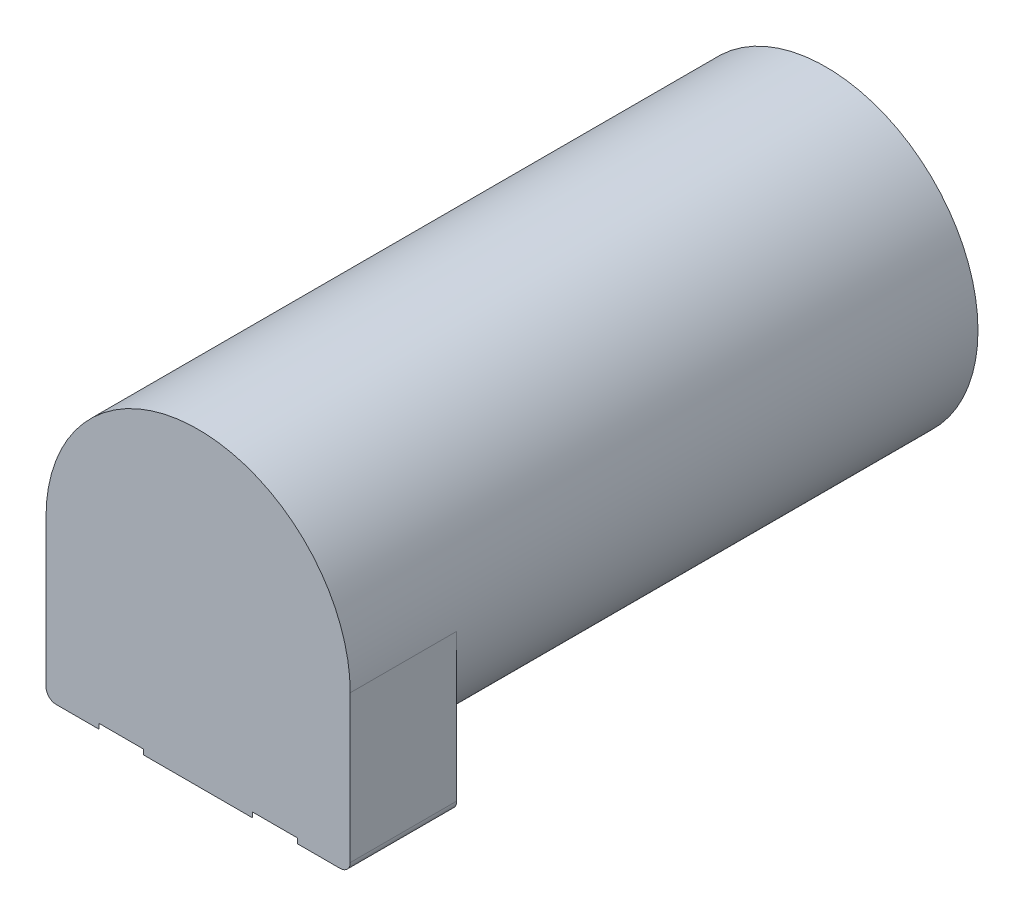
SolidWorks part; units mm, degrees
ref_plane "Face" through (0, 0, 0) normal (0, 0, 1) x (1, 0, 0)
ref_plane "Dessus" through (0, 0, 0) normal (0, 1, 0) x (1, 0, 0)
ref_plane "Droite" through (0, 0, 0) normal (1, 0, 0) x (0, 0, -1)
sketch "Esquisse1" plane through (0, 0, 0) normal (1, 0, 0) x (0, 0, -1)
  line L0 (0, 0) -> (36.7, 0) construction
  line L1 (0, 0) -> (0, 15.75)
  line L2 (0, 15.75) -> (5, 15.75)
  line L3 (5, 15.75) -> (5, 0)
  line L8 (0, 0) -> (5, 0)
  dimension "D2" = 5
  dimension "D4" = 31.5
revolve "Révolution1" add sketch "Esquisse1" angle 360 about L0
sketch "Esquisse5" plane through (0, 0, 0) normal (0, 0, 1) x (1, 0, 0)
  circle A0 centre (0, 0) radius 30
  dimension "D1" = 60
extrude "Extrusion2" add sketch "Esquisse5" along normal blind 123.8
sketch "Esquisse6" plane through (0, 0, 123.8) normal (0, 0, 1) x (1, 0, 0)
  line L0 (-30, 0) -> (-30, -29)
  line L1 (-28, -31) -> (28, -31)
  line L2 (30, -29) -> (30, 0)
  line L3 (30, 0) -> (-30, 0) construction
  circle A0 centre (0, 0) radius 30 construction
  arc A1 (-30, -29) -> (-28, -31) centre (-28, -29) ccw
  arc A2 (28, -31) -> (30, -29) centre (28, -29) ccw
  arc A4 (-30, 0) -> (30, 0) centre (0, 0) ccw
  dimension "D1" = 61
  dimension "D2" = 2
extrude "Extrusion3" add sketch "Esquisse6" against normal blind 21
sketch "Esquisse7" plane through (0, -31, 0) normal (0, -1, 0) x (1, 0, 0)
  line L0 (0, 123.8) -> (0, 112.1) construction
  line L1 (-28, 123.8) -> (28, 123.8) construction
  line L2 (-15.15, 112.1) -> (15.15, 112.1) construction
  circle A0 centre (-15.15, 112.1) radius 12.5
  circle A1 centre (15.15, 112.1) radius 12.5
  point P6 (15.15, 112.1)
  point P7 (-15.15, 112.1)
  dimension "D3" = 25
  dimension "D1" = 30.3
  dimension "D2" = 11.7
extrude "Enlèv. mat.-Extru.1" cut sketch "Esquisse7" against normal blind 1
sketch "Esquisse8" plane through (0, -30, 0) normal (0, -1, 0) x (1, 0, 0)
  circle A0 centre (15.15, 112.1) radius 7.475
  circle A1 centre (-15.15, 112.1) radius 7.475
  arc A2 (-6.7978, 102.8) -> (-10.75, 123.8) centre (-15.15, 112.1) ccw construction
  arc A3 (23.5022, 102.8) -> (19.55, 123.8) centre (15.15, 112.1) ccw construction
  dimension "D1" = 14.95
extrude "Enlèv. mat.-Extru.2" cut sketch "Esquisse8" against normal blind 30
sketch "Esquisse11" plane through (0, 0, 0) normal (0, 0, -1) x (-1, 0, 0)
  line L0 (0, 0) -> (0, -22.5) construction
  line L1 (0, 0) -> (15.9099, 15.9099) construction
  line L2 (15.9099, 15.9099) -> (-15.9099, 15.9099) construction
  line L3 (-15.9099, 15.9099) -> (0, 0) construction
  circle A0 centre (0, 0) radius 22.5 construction
  point P4 (0, -22.5)
  point P5 (-15.9099, 15.9099)
  point P6 (15.9099, 15.9099)
  dimension "D1" = 45
  dimension "D2" = 90
hole_wizard "Trou taraudé M6x1.02" positions "Esquisse3D2" profile "Esquisse12" tap size "M6x1.0" standard "ISO"
sketch3d "Esquisse3D2"
  point P0 (0, -22.5, 0)
  point P2 (-15.9099, 15.9099, 0)
  point P4 (15.9099, 15.9099, 0)
sketch "Esquisse12" plane through (0, -22.5, 0) normal (1, 0, 0) x (0, 1, 0)
  line L0 (0, 0) -> (0, 16.5022)
  line L1 (0, 16.5022) -> (2.5, 15)
  line L2 (2.5, 15) -> (2.5, 0)
  line L5 (2.5, 0) -> (0, 0)
  line L10 (0, 16.5022) -> (-2.5, 15) construction
  line L11 (0, -6.35) -> (0, 107.95) construction
  dimension "Diamètre du trou pour taraudage" = 5
  dimension "Profondeur du trou pour taraudage" = 15
  dimension "Angle de pointe" = 118
chamfer "Chanfrein1" distance 1 angle 45 1 edges at (15.75, 0, -5)
